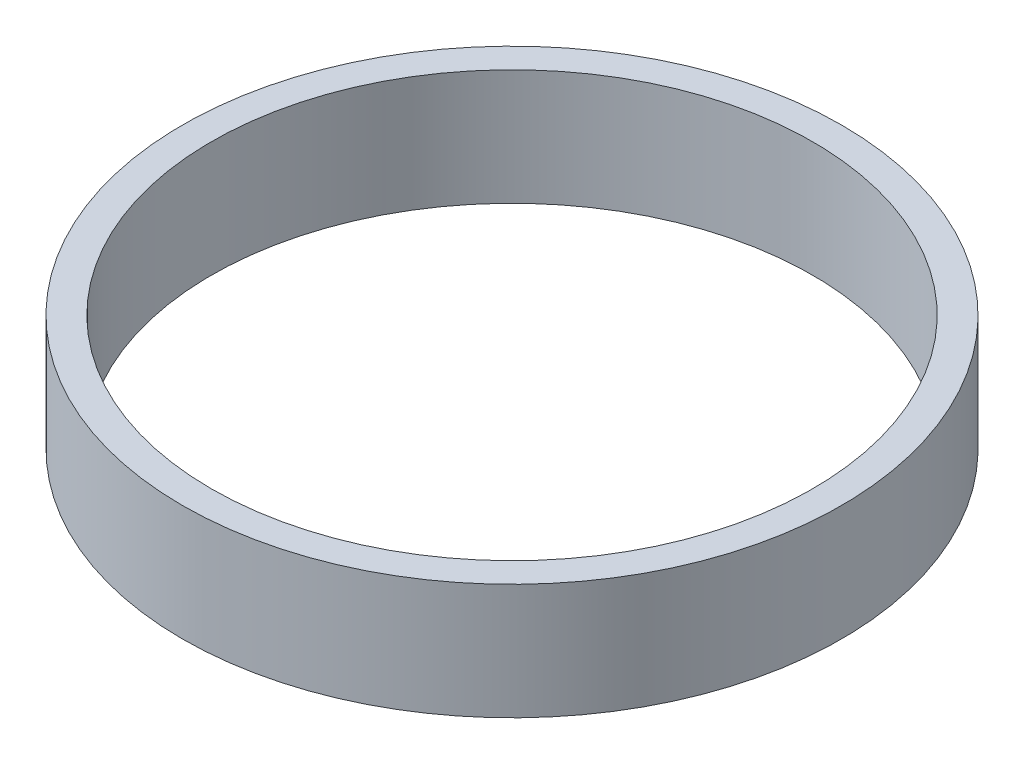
SolidWorks part; units mm, degrees
ref_plane "Front Plane" through (0, 0, 0) normal (0, 0, 1) x (1, 0, 0)
ref_plane "Top Plane" through (0, 0, 0) normal (0, 1, 0) x (1, 0, 0)
ref_plane "Right Plane" through (0, 0, 0) normal (1, 0, 0) x (0, 0, -1)
sketch "Sketch2" plane through (0, 0, 0) normal (0, 1, 0) x (1, 0, 0)
  circle A0 centre (0, 0) radius 72.39
  circle A1 centre (0, 0) radius 66.04
  dimension "D1" = 144.78
  dimension "D2" = 6.35
extrude "Boss-Extrude1" add sketch "Sketch2" along normal mid plane 25.4
